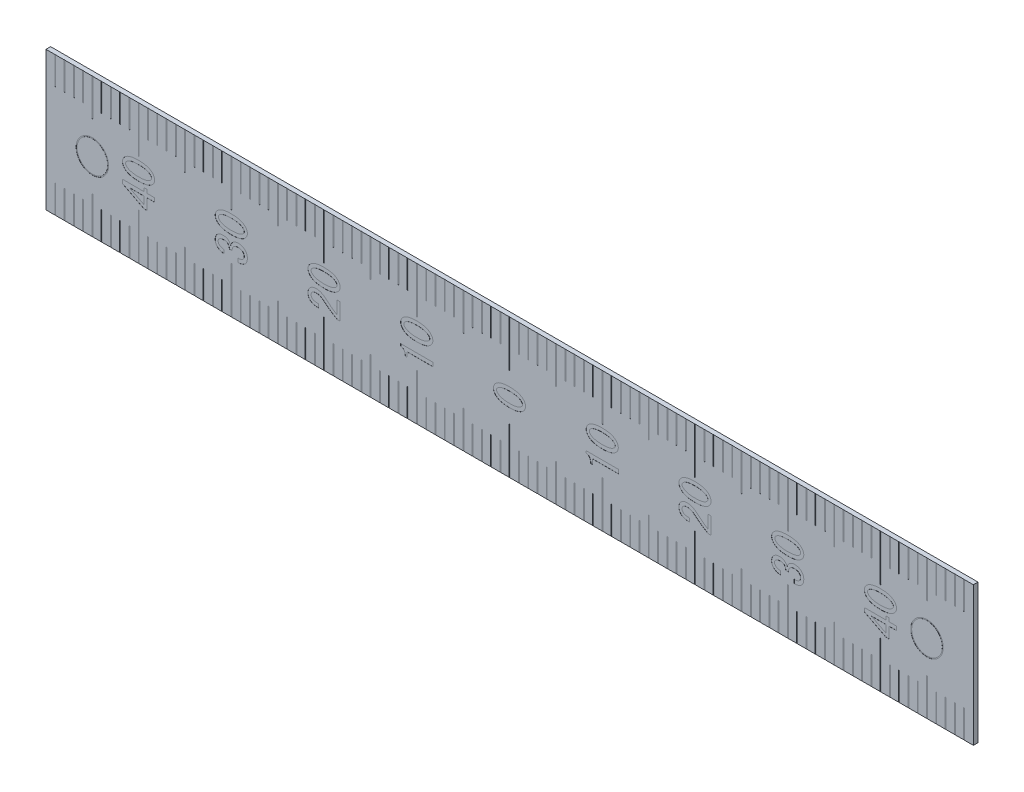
SolidWorks part; units mm, degrees
ref_plane "Front" through (0, 0, 0) normal (0, 0, 1) x (1, 0, 0)
ref_plane "Top" through (0, 0, 0) normal (0, 1, 0) x (1, 0, 0)
ref_plane "Right" through (0, 0, 0) normal (1, 0, 0) x (0, 0, -1)
sketch "Sketch1" plane through (0, 0, 0) normal (0, 0, 1) x (1, 0, 0)
  line L1 (0, -50) -> (0, 50)
  line L2 (0, -50) -> (15, -50)
  line L3 (15, -50) -> (15, 50)
  line L4 (0, 50) -> (15, 50)
  dimension "D1" = 100
  dimension "D2" = 15
extrude "Extrude1" add sketch "Sketch1" along normal blind 0.5
sketch "Sketch2" plane through (0, 0, 0.5) normal (0, 0, 1) x (1, 0, 0)
  line L0 (0, 50) -> (0, -50) construction
  line L1 (0, -50) -> (15, -50) construction
  line L2 (15, 50) -> (0, 50) construction
  circle A0 centre (7.5, -45) radius 1.75
  circle A1 centre (7.5, 45) radius 1.75
  circle A2 centre (7.5, -45) radius 1.65
  circle A3 centre (7.5, 45) radius 1.65
  dimension "D1" = 7.5
  dimension "D2" = 7.5
  dimension "D3" = 5
  dimension "D4" = 5
  dimension "D5" = 3.5
  dimension "D6" = 3.5
  dimension "D7" = 0.1
extrude "Extrude2" cut sketch "Sketch2" against normal blind 0.01
sketch "Sketch3" plane through (0, 0, 0.5) normal (0, 0, 1) x (1, 0, 0)
  line L0 (15, 50) -> (0, 50) construction
  line L1 (5.25, 28.25) -> (9.75, 28.25) construction
  line L2 (5.25, 18.25) -> (9.75, 18.25) construction
  line L3 (5.25, 8.25) -> (9.75, 8.25) construction
  line L5 (0, 50) -> (0, -50) construction
  line L6 (6.375, -1.75) -> (10.875, -1.75) construction
  line L7 (5.25, 38.25) -> (9.75, 38.25) construction
  line L8 (5.25, 38.25) -> (5.25, 41.75) construction
  line L9 (7.5, -50) -> (7.5, 50) construction
  line L10 (0, -50) -> (15, -50) construction
  line L11 (0, 40) -> (15, 40) construction
  line L12 (15, -50) -> (15, 50) construction
  line L13 (5.25, 41.75) -> (9.75, 41.75) construction
  line L14 (9.75, 38.25) -> (9.75, 41.75) construction
  line L15 (5.25, 38.25) -> (9.75, 41.75) construction
  line L16 (5.25, 41.75) -> (9.75, 38.25) construction
  line L17 (5.25, -11.75) -> (9.75, -11.75) construction
  line L18 (5.25, -21.75) -> (9.75, -21.75) construction
  line L19 (5.25, -31.75) -> (9.75, -31.75) construction
  line L20 (5.25, -41.75) -> (9.75, -41.75) construction
  circle A0 centre (7.5, 45) radius 1.75 construction
  text T0 "40" font "ＭＳ ゴシック" height 3.5
  text T1 "30" font "ＭＳ ゴシック" height 3.5
  text T2 "20" font "ＭＳ ゴシック" height 3.5
  text T3 "10" font "ＭＳ ゴシック" height 3.5
  text T4 "0"
  text T5 "10"
  text T6 "20"
  text T7 "30"
  text T8 "40"
  point P7 (7.5, 40)
  dimension "D2" = 7.5
  dimension "D1" = 4
  dimension "D3" = 1.125
  dimension "D6" = 10
  dimension "D5" = 4.5
  dimension "D7" = 3.5
extrude "Extrude3" cut sketch "Sketch3" against normal blind 0.01
sketch "Sketch4" plane through (0, 0, 0.5) normal (0, 0, 1) x (1, 0, 0)
  line L0 (15, 40.05) -> (10, 40.05)
  line L1 (15, -50) -> (15, 50) construction
  line L2 (10, 40.05) -> (10, 39.95)
  line L3 (10, 39.95) -> (15, 39.95)
  line L4 (15, 39.95) -> (15, 40.05)
  line L5 (15, 50) -> (0, 50) construction
  line L6 (15, 48.05) -> (15, 47.95)
  line L7 (15, 44.95) -> (11, 44.95)
  line L8 (15, 44.95) -> (15, 45.05)
  line L9 (15, 45.05) -> (11, 45.05)
  line L10 (11, 44.95) -> (11, 45.05)
  line L11 (15, 49.05) -> (12, 49.05)
  line L12 (15, 49.05) -> (15, 48.95)
  line L13 (15, 48.95) -> (12, 48.95)
  line L14 (12, 49.05) -> (12, 48.95)
  line L15 (15, 48.05) -> (12, 48.05)
  line L16 (15, 47.95) -> (12, 47.95)
  line L17 (12, 48.05) -> (12, 47.95)
  line L18 (15, 47.05) -> (15, 46.95)
  line L19 (15, 47.05) -> (12, 47.05)
  line L20 (15, 46.95) -> (12, 46.95)
  line L21 (12, 47.05) -> (12, 46.95)
  line L22 (15, 46.05) -> (15, 45.95)
  line L23 (15, 46.05) -> (12, 46.05)
  line L24 (15, 45.95) -> (12, 45.95)
  line L25 (12, 46.05) -> (12, 45.95)
  line L26 (15, 30.05) -> (10, 30.05)
  line L27 (10, 30.05) -> (10, 29.95)
  line L28 (10, 29.95) -> (15, 29.95)
  line L29 (15, 29.95) -> (15, 30.05)
  line L30 (15, 44.05) -> (15, 43.95)
  line L31 (15, 44.05) -> (12, 44.05)
  line L32 (15, 43.95) -> (12, 43.95)
  line L33 (12, 44.05) -> (12, 43.95)
  line L34 (15, 43.05) -> (15, 42.95)
  line L35 (15, 43.05) -> (12, 43.05)
  line L36 (15, 42.95) -> (12, 42.95)
  line L37 (12, 43.05) -> (12, 42.95)
  line L38 (15, 42.05) -> (15, 41.95)
  line L39 (15, 42.05) -> (12, 42.05)
  line L40 (15, 41.95) -> (12, 41.95)
  line L41 (12, 42.05) -> (12, 41.95)
  line L42 (15, 41.05) -> (15, 40.95)
  line L43 (15, 41.05) -> (12, 41.05)
  line L44 (15, 40.95) -> (12, 40.95)
  line L45 (12, 41.05) -> (12, 40.95)
  line L46 (12, 45.05) -> (12, 44.95)
  line L47 (15, 45.05) -> (12, 45.05)
  line L48 (15, 44.95) -> (12, 44.95)
  line L49 (15, 45.05) -> (15, 44.95)
  line L50 (15, 38.05) -> (15, 37.95)
  line L51 (15, 34.95) -> (11, 34.95)
  line L52 (15, 34.95) -> (15, 35.05)
  line L53 (15, 35.05) -> (11, 35.05)
  line L54 (11, 34.95) -> (11, 35.05)
  line L55 (15, 39.05) -> (12, 39.05)
  line L56 (15, 39.05) -> (15, 38.95)
  line L57 (15, 38.95) -> (12, 38.95)
  line L58 (12, 39.05) -> (12, 38.95)
  line L59 (15, 38.05) -> (12, 38.05)
  line L60 (15, 37.95) -> (12, 37.95)
  line L61 (12, 38.05) -> (12, 37.95)
  line L62 (15, 37.05) -> (15, 36.95)
  line L63 (15, 37.05) -> (12, 37.05)
  line L64 (15, 36.95) -> (12, 36.95)
  line L65 (12, 37.05) -> (12, 36.95)
  line L66 (15, 36.05) -> (15, 35.95)
  line L67 (15, 36.05) -> (12, 36.05)
  line L68 (15, 35.95) -> (12, 35.95)
  line L69 (12, 36.05) -> (12, 35.95)
  line L70 (15, 34.05) -> (15, 33.95)
  line L71 (15, 34.05) -> (12, 34.05)
  line L72 (15, 33.95) -> (12, 33.95)
  line L73 (12, 34.05) -> (12, 33.95)
  line L74 (15, 33.05) -> (15, 32.95)
  line L75 (15, 33.05) -> (12, 33.05)
  line L76 (15, 32.95) -> (12, 32.95)
  line L77 (12, 33.05) -> (12, 32.95)
  line L78 (15, 32.05) -> (15, 31.95)
  line L79 (15, 32.05) -> (12, 32.05)
  line L80 (15, 31.95) -> (12, 31.95)
  line L81 (12, 32.05) -> (12, 31.95)
  line L82 (15, 31.05) -> (15, 30.95)
  line L83 (15, 31.05) -> (12, 31.05)
  line L84 (15, 30.95) -> (12, 30.95)
  line L85 (12, 31.05) -> (12, 30.95)
  line L86 (15, 20.05) -> (10, 20.05)
  line L87 (10, 20.05) -> (10, 19.95)
  line L88 (10, 19.95) -> (15, 19.95)
  line L89 (15, 19.95) -> (15, 20.05)
  line L90 (15, 28.05) -> (15, 27.95)
  line L91 (15, 24.95) -> (11, 24.95)
  line L92 (15, 24.95) -> (15, 25.05)
  line L93 (15, 25.05) -> (11, 25.05)
  line L94 (11, 24.95) -> (11, 25.05)
  line L95 (15, 29.05) -> (12, 29.05)
  line L96 (15, 29.05) -> (15, 28.95)
  line L97 (15, 28.95) -> (12, 28.95)
  line L98 (12, 29.05) -> (12, 28.95)
  line L99 (15, 28.05) -> (12, 28.05)
  line L100 (15, 27.95) -> (12, 27.95)
  line L101 (12, 28.05) -> (12, 27.95)
  line L102 (15, 27.05) -> (15, 26.95)
  line L103 (15, 27.05) -> (12, 27.05)
  line L104 (15, 26.95) -> (12, 26.95)
  line L105 (12, 27.05) -> (12, 26.95)
  line L106 (15, 26.05) -> (15, 25.95)
  line L107 (15, 26.05) -> (12, 26.05)
  line L108 (15, 25.95) -> (12, 25.95)
  line L109 (12, 26.05) -> (12, 25.95)
  line L110 (15, 24.05) -> (15, 23.95)
  line L111 (15, 24.05) -> (12, 24.05)
  line L112 (15, 23.95) -> (12, 23.95)
  line L113 (12, 24.05) -> (12, 23.95)
  line L114 (15, 23.05) -> (15, 22.95)
  line L115 (15, 23.05) -> (12, 23.05)
  line L116 (15, 22.95) -> (12, 22.95)
  line L117 (12, 23.05) -> (12, 22.95)
  line L118 (15, 22.05) -> (15, 21.95)
  line L119 (15, 22.05) -> (12, 22.05)
  line L120 (15, 21.95) -> (12, 21.95)
  line L121 (12, 22.05) -> (12, 21.95)
  line L122 (15, 21.05) -> (15, 20.95)
  line L123 (15, 21.05) -> (12, 21.05)
  line L124 (15, 20.95) -> (12, 20.95)
  line L125 (12, 21.05) -> (12, 20.95)
  line L126 (15, 10.05) -> (10, 10.05)
  line L127 (10, 10.05) -> (10, 9.95)
  line L128 (10, 9.95) -> (15, 9.95)
  line L129 (15, 9.95) -> (15, 10.05)
  line L130 (15, 18.05) -> (15, 17.95)
  line L131 (15, 14.95) -> (11, 14.95)
  line L132 (15, 14.95) -> (15, 15.05)
  line L133 (15, 15.05) -> (11, 15.05)
  line L134 (11, 14.95) -> (11, 15.05)
  line L135 (15, 19.05) -> (12, 19.05)
  line L136 (15, 19.05) -> (15, 18.95)
  line L137 (15, 18.95) -> (12, 18.95)
  line L138 (12, 19.05) -> (12, 18.95)
  line L139 (15, 18.05) -> (12, 18.05)
  line L140 (15, 17.95) -> (12, 17.95)
  line L141 (12, 18.05) -> (12, 17.95)
  line L142 (15, 17.05) -> (15, 16.95)
  line L143 (15, 17.05) -> (12, 17.05)
  line L144 (15, 16.95) -> (12, 16.95)
  line L145 (12, 17.05) -> (12, 16.95)
  line L146 (15, 16.05) -> (15, 15.95)
  line L147 (15, 16.05) -> (12, 16.05)
  line L148 (15, 15.95) -> (12, 15.95)
  line L149 (12, 16.05) -> (12, 15.95)
  line L150 (15, 14.05) -> (15, 13.95)
  line L151 (15, 14.05) -> (12, 14.05)
  line L152 (15, 13.95) -> (12, 13.95)
  line L153 (12, 14.05) -> (12, 13.95)
  line L154 (15, 13.05) -> (15, 12.95)
  line L155 (15, 13.05) -> (12, 13.05)
  line L156 (15, 12.95) -> (12, 12.95)
  line L157 (12, 13.05) -> (12, 12.95)
  line L158 (15, 12.05) -> (15, 11.95)
  line L159 (15, 12.05) -> (12, 12.05)
  line L160 (15, 11.95) -> (12, 11.95)
  line L161 (12, 12.05) -> (12, 11.95)
  line L162 (15, 11.05) -> (15, 10.95)
  line L163 (15, 11.05) -> (12, 11.05)
  line L164 (15, 10.95) -> (12, 10.95)
  line L165 (12, 11.05) -> (12, 10.95)
  line L166 (7.5, 50) -> (7.5, 36.693) construction
  line L167 (3, 1.05) -> (3, 0.95)
  line L168 (0, 0.95) -> (3, 0.95)
  line L169 (0, 1.05) -> (3, 1.05)
  line L170 (15, 8.05) -> (15, 7.95)
  line L171 (15, 4.95) -> (11, 4.95)
  line L172 (15, 4.95) -> (15, 5.05)
  line L173 (15, 5.05) -> (11, 5.05)
  line L174 (11, 4.95) -> (11, 5.05)
  line L175 (15, 9.05) -> (12, 9.05)
  line L176 (15, 9.05) -> (15, 8.95)
  line L177 (15, 8.95) -> (12, 8.95)
  line L178 (12, 9.05) -> (12, 8.95)
  line L179 (15, 8.05) -> (12, 8.05)
  line L180 (15, 7.95) -> (12, 7.95)
  line L181 (12, 8.05) -> (12, 7.95)
  line L182 (15, 7.05) -> (15, 6.95)
  line L183 (15, 7.05) -> (12, 7.05)
  line L184 (15, 6.95) -> (12, 6.95)
  line L185 (12, 7.05) -> (12, 6.95)
  line L186 (15, 6.05) -> (15, 5.95)
  line L187 (15, 6.05) -> (12, 6.05)
  line L188 (15, 5.95) -> (12, 5.95)
  line L189 (12, 6.05) -> (12, 5.95)
  line L190 (15, 4.05) -> (15, 3.95)
  line L191 (15, 4.05) -> (12, 4.05)
  line L192 (15, 3.95) -> (12, 3.95)
  line L193 (12, 4.05) -> (12, 3.95)
  line L194 (15, 3.05) -> (15, 2.95)
  line L195 (15, 3.05) -> (12, 3.05)
  line L196 (15, 2.95) -> (12, 2.95)
  line L197 (12, 3.05) -> (12, 2.95)
  line L198 (15, 2.05) -> (15, 1.95)
  line L199 (15, 2.05) -> (12, 2.05)
  line L200 (15, 1.95) -> (12, 1.95)
  line L201 (12, 2.05) -> (12, 1.95)
  line L202 (15, 1.05) -> (15, 0.95)
  line L203 (15, 1.05) -> (12, 1.05)
  line L204 (15, 0.95) -> (12, 0.95)
  line L205 (12, 1.05) -> (12, 0.95)
  line L206 (15, 0.05) -> (10, 0.05)
  line L207 (10, 0.05) -> (10, -0.05)
  line L208 (10, -0.05) -> (15, -0.05)
  line L209 (15, -0.05) -> (15, 0.05)
  line L210 (0, 1.05) -> (0, 0.95)
  line L211 (3, 2.05) -> (3, 1.95)
  line L212 (0, 1.95) -> (3, 1.95)
  line L213 (0, 2.05) -> (3, 2.05)
  line L214 (0, 2.05) -> (0, 1.95)
  line L215 (3, 3.05) -> (3, 2.95)
  line L216 (0, 2.95) -> (3, 2.95)
  line L217 (0, 3.05) -> (3, 3.05)
  line L218 (0, 3.05) -> (0, 2.95)
  line L219 (3, 4.05) -> (3, 3.95)
  line L220 (0, 3.95) -> (3, 3.95)
  line L221 (0, 4.05) -> (3, 4.05)
  line L222 (0, 4.05) -> (0, 3.95)
  line L223 (3, 6.05) -> (3, 5.95)
  line L224 (0, 5.95) -> (3, 5.95)
  line L225 (0, 6.05) -> (3, 6.05)
  line L226 (0, 6.05) -> (0, 5.95)
  line L227 (3, 7.05) -> (3, 6.95)
  line L228 (0, 6.95) -> (3, 6.95)
  line L229 (0, 7.05) -> (3, 7.05)
  line L230 (0, 7.05) -> (0, 6.95)
  line L231 (3, 8.05) -> (3, 7.95)
  line L232 (0, 7.95) -> (3, 7.95)
  line L233 (0, 8.05) -> (3, 8.05)
  line L234 (3, 9.05) -> (3, 8.95)
  line L235 (0, 8.95) -> (3, 8.95)
  line L236 (0, 9.05) -> (0, 8.95)
  line L237 (0, 9.05) -> (3, 9.05)
  line L238 (4, 4.95) -> (4, 5.05)
  line L239 (0, 5.05) -> (4, 5.05)
  line L240 (0, 4.95) -> (0, 5.05)
  line L241 (0, 4.95) -> (4, 4.95)
  line L242 (0, 8.05) -> (0, 7.95)
  line L243 (3, 11.05) -> (3, 10.95)
  line L244 (0, 10.95) -> (3, 10.95)
  line L245 (0, 11.05) -> (3, 11.05)
  line L246 (0, 11.05) -> (0, 10.95)
  line L247 (3, 12.05) -> (3, 11.95)
  line L248 (0, 11.95) -> (3, 11.95)
  line L249 (0, 12.05) -> (3, 12.05)
  line L250 (0, 12.05) -> (0, 11.95)
  line L251 (3, 13.05) -> (3, 12.95)
  line L252 (0, 12.95) -> (3, 12.95)
  line L253 (0, 13.05) -> (3, 13.05)
  line L254 (0, 13.05) -> (0, 12.95)
  line L255 (3, 14.05) -> (3, 13.95)
  line L256 (0, 13.95) -> (3, 13.95)
  line L257 (0, 14.05) -> (3, 14.05)
  line L258 (0, 14.05) -> (0, 13.95)
  line L259 (3, 16.05) -> (3, 15.95)
  line L260 (0, 15.95) -> (3, 15.95)
  line L261 (0, 16.05) -> (3, 16.05)
  line L262 (0, 16.05) -> (0, 15.95)
  line L263 (3, 17.05) -> (3, 16.95)
  line L264 (0, 16.95) -> (3, 16.95)
  line L265 (0, 17.05) -> (3, 17.05)
  line L266 (0, 17.05) -> (0, 16.95)
  line L267 (3, 18.05) -> (3, 17.95)
  line L268 (0, 17.95) -> (3, 17.95)
  line L269 (0, 18.05) -> (3, 18.05)
  line L270 (3, 19.05) -> (3, 18.95)
  line L271 (0, 18.95) -> (3, 18.95)
  line L272 (0, 19.05) -> (0, 18.95)
  line L273 (0, 19.05) -> (3, 19.05)
  line L274 (4, 14.95) -> (4, 15.05)
  line L275 (0, 15.05) -> (4, 15.05)
  line L276 (0, 14.95) -> (0, 15.05)
  line L277 (0, 14.95) -> (4, 14.95)
  line L278 (0, 18.05) -> (0, 17.95)
  line L279 (0, 9.95) -> (0, 10.05)
  line L280 (5, 9.95) -> (0, 9.95)
  line L281 (5, 10.05) -> (5, 9.95)
  line L282 (0, 10.05) -> (5, 10.05)
  line L283 (3, 21.05) -> (3, 20.95)
  line L284 (0, 20.95) -> (3, 20.95)
  line L285 (0, 21.05) -> (3, 21.05)
  line L286 (0, 21.05) -> (0, 20.95)
  line L287 (3, 22.05) -> (3, 21.95)
  line L288 (0, 21.95) -> (3, 21.95)
  line L289 (0, 22.05) -> (3, 22.05)
  line L290 (0, 22.05) -> (0, 21.95)
  line L291 (3, 23.05) -> (3, 22.95)
  line L292 (0, 22.95) -> (3, 22.95)
  line L293 (0, 23.05) -> (3, 23.05)
  line L294 (0, 23.05) -> (0, 22.95)
  line L295 (3, 24.05) -> (3, 23.95)
  line L296 (0, 23.95) -> (3, 23.95)
  line L297 (0, 24.05) -> (3, 24.05)
  line L298 (0, 24.05) -> (0, 23.95)
  line L299 (3, 26.05) -> (3, 25.95)
  line L300 (0, 25.95) -> (3, 25.95)
  line L301 (0, 26.05) -> (3, 26.05)
  line L302 (0, 26.05) -> (0, 25.95)
  line L303 (3, 27.05) -> (3, 26.95)
  line L304 (0, 26.95) -> (3, 26.95)
  line L305 (0, 27.05) -> (3, 27.05)
  line L306 (0, 27.05) -> (0, 26.95)
  line L307 (3, 28.05) -> (3, 27.95)
  line L308 (0, 27.95) -> (3, 27.95)
  line L309 (0, 28.05) -> (3, 28.05)
  line L310 (3, 29.05) -> (3, 28.95)
  line L311 (0, 28.95) -> (3, 28.95)
  line L312 (0, 29.05) -> (0, 28.95)
  line L313 (0, 29.05) -> (3, 29.05)
  line L314 (4, 24.95) -> (4, 25.05)
  line L315 (0, 25.05) -> (4, 25.05)
  line L316 (0, 24.95) -> (0, 25.05)
  line L317 (0, 24.95) -> (4, 24.95)
  line L318 (0, 28.05) -> (0, 27.95)
  line L319 (0, 19.95) -> (0, 20.05)
  line L320 (5, 19.95) -> (0, 19.95)
  line L321 (5, 20.05) -> (5, 19.95)
  line L322 (0, 20.05) -> (5, 20.05)
  line L323 (3, 31.05) -> (3, 30.95)
  line L324 (0, 30.95) -> (3, 30.95)
  line L325 (0, 31.05) -> (3, 31.05)
  line L326 (0, 31.05) -> (0, 30.95)
  line L327 (3, 32.05) -> (3, 31.95)
  line L328 (0, 31.95) -> (3, 31.95)
  line L329 (0, 32.05) -> (3, 32.05)
  line L330 (0, 32.05) -> (0, 31.95)
  line L331 (3, 33.05) -> (3, 32.95)
  line L332 (0, 32.95) -> (3, 32.95)
  line L333 (0, 33.05) -> (3, 33.05)
  line L334 (0, 33.05) -> (0, 32.95)
  line L335 (3, 34.05) -> (3, 33.95)
  line L336 (0, 33.95) -> (3, 33.95)
  line L337 (0, 34.05) -> (3, 34.05)
  line L338 (0, 34.05) -> (0, 33.95)
  line L339 (3, 36.05) -> (3, 35.95)
  line L340 (0, 35.95) -> (3, 35.95)
  line L341 (0, 36.05) -> (3, 36.05)
  line L342 (0, 36.05) -> (0, 35.95)
  line L343 (3, 37.05) -> (3, 36.95)
  line L344 (0, 36.95) -> (3, 36.95)
  line L345 (0, 37.05) -> (3, 37.05)
  line L346 (0, 37.05) -> (0, 36.95)
  line L347 (3, 38.05) -> (3, 37.95)
  line L348 (0, 37.95) -> (3, 37.95)
  line L349 (0, 38.05) -> (3, 38.05)
  line L350 (3, 39.05) -> (3, 38.95)
  line L351 (0, 38.95) -> (3, 38.95)
  line L352 (0, 39.05) -> (0, 38.95)
  line L353 (0, 39.05) -> (3, 39.05)
  line L354 (4, 34.95) -> (4, 35.05)
  line L355 (0, 35.05) -> (4, 35.05)
  line L356 (0, 34.95) -> (0, 35.05)
  line L357 (0, 34.95) -> (4, 34.95)
  line L358 (0, 38.05) -> (0, 37.95)
  line L359 (3, 41.05) -> (3, 40.95)
  line L360 (0, 40.95) -> (3, 40.95)
  line L361 (0, 41.05) -> (3, 41.05)
  line L362 (0, 41.05) -> (0, 40.95)
  line L363 (3, 42.05) -> (3, 41.95)
  line L364 (0, 41.95) -> (3, 41.95)
  line L365 (0, 42.05) -> (3, 42.05)
  line L366 (0, 42.05) -> (0, 41.95)
  line L367 (3, 43.05) -> (3, 42.95)
  line L368 (0, 42.95) -> (3, 42.95)
  line L369 (0, 43.05) -> (3, 43.05)
  line L370 (0, 43.05) -> (0, 42.95)
  line L371 (3, 44.05) -> (3, 43.95)
  line L372 (0, 43.95) -> (3, 43.95)
  line L373 (0, 44.05) -> (3, 44.05)
  line L374 (0, 44.05) -> (0, 43.95)
  line L375 (0, 29.95) -> (0, 30.05)
  line L376 (5, 29.95) -> (0, 29.95)
  line L377 (5, 30.05) -> (5, 29.95)
  line L378 (0, 30.05) -> (5, 30.05)
  line L379 (3, 46.05) -> (3, 45.95)
  line L380 (0, 45.95) -> (3, 45.95)
  line L381 (0, 46.05) -> (3, 46.05)
  line L382 (0, 46.05) -> (0, 45.95)
  line L383 (3, 47.05) -> (3, 46.95)
  line L384 (0, 46.95) -> (3, 46.95)
  line L385 (0, 47.05) -> (3, 47.05)
  line L386 (0, 47.05) -> (0, 46.95)
  line L387 (3, 48.05) -> (3, 47.95)
  line L388 (0, 47.95) -> (3, 47.95)
  line L389 (0, 48.05) -> (3, 48.05)
  line L390 (3, 49.05) -> (3, 48.95)
  line L391 (0, 48.95) -> (3, 48.95)
  line L392 (0, 49.05) -> (0, 48.95)
  line L393 (0, 49.05) -> (3, 49.05)
  line L394 (4, 44.95) -> (4, 45.05)
  line L395 (0, 45.05) -> (4, 45.05)
  line L396 (0, 44.95) -> (0, 45.05)
  line L397 (0, 44.95) -> (4, 44.95)
  line L398 (0, 48.05) -> (0, 47.95)
  line L399 (0, 39.95) -> (0, 40.05)
  line L400 (5, 39.95) -> (0, 39.95)
  line L401 (5, 40.05) -> (5, 39.95)
  line L402 (0, 40.05) -> (5, 40.05)
  line L403 (15, 0.05) -> (10, 0.05)
  line L404 (10, 0.05) -> (10, -0.05)
  line L405 (10, -0.05) -> (15, -0.05)
  line L406 (15, -0.05) -> (15, 0.05)
  line L407 (3, -8.95) -> (3, -9.05)
  line L408 (0, -9.05) -> (3, -9.05)
  line L409 (0, -8.95) -> (3, -8.95)
  line L410 (15, -1.95) -> (15, -2.05)
  line L411 (15, -5.05) -> (11, -5.05)
  line L412 (15, -5.05) -> (15, -4.95)
  line L413 (15, -4.95) -> (11, -4.95)
  line L414 (11, -5.05) -> (11, -4.95)
  line L415 (15, -0.95) -> (12, -0.95)
  line L416 (15, -0.95) -> (15, -1.05)
  line L417 (15, -1.05) -> (12, -1.05)
  line L418 (12, -0.95) -> (12, -1.05)
  line L419 (15, -1.95) -> (12, -1.95)
  line L420 (15, -2.05) -> (12, -2.05)
  line L421 (12, -1.95) -> (12, -2.05)
  line L422 (15, -2.95) -> (15, -3.05)
  line L423 (15, -2.95) -> (12, -2.95)
  line L424 (15, -3.05) -> (12, -3.05)
  line L425 (12, -2.95) -> (12, -3.05)
  line L426 (15, -3.95) -> (15, -4.05)
  line L427 (15, -3.95) -> (12, -3.95)
  line L428 (15, -4.05) -> (12, -4.05)
  line L429 (12, -3.95) -> (12, -4.05)
  line L430 (15, -5.95) -> (15, -6.05)
  line L431 (15, -5.95) -> (12, -5.95)
  line L432 (15, -6.05) -> (12, -6.05)
  line L433 (12, -5.95) -> (12, -6.05)
  line L434 (15, -6.95) -> (15, -7.05)
  line L435 (15, -6.95) -> (12, -6.95)
  line L436 (15, -7.05) -> (12, -7.05)
  line L437 (12, -6.95) -> (12, -7.05)
  line L438 (15, -7.95) -> (15, -8.05)
  line L439 (15, -7.95) -> (12, -7.95)
  line L440 (15, -8.05) -> (12, -8.05)
  line L441 (12, -7.95) -> (12, -8.05)
  line L442 (15, -8.95) -> (15, -9.05)
  line L443 (15, -8.95) -> (12, -8.95)
  line L444 (15, -9.05) -> (12, -9.05)
  line L445 (12, -8.95) -> (12, -9.05)
  line L446 (0, -8.95) -> (0, -9.05)
  line L447 (3, -7.95) -> (3, -8.05)
  line L448 (0, -8.05) -> (3, -8.05)
  line L449 (0, -7.95) -> (3, -7.95)
  line L450 (0, -7.95) -> (0, -8.05)
  line L451 (3, -6.95) -> (3, -7.05)
  line L452 (0, -7.05) -> (3, -7.05)
  line L453 (0, -6.95) -> (3, -6.95)
  line L454 (0, -6.95) -> (0, -7.05)
  line L455 (3, -5.95) -> (3, -6.05)
  line L456 (0, -6.05) -> (3, -6.05)
  line L457 (0, -5.95) -> (3, -5.95)
  line L458 (0, -5.95) -> (0, -6.05)
  line L459 (3, -3.95) -> (3, -4.05)
  line L460 (0, -4.05) -> (3, -4.05)
  line L461 (0, -3.95) -> (3, -3.95)
  line L462 (0, -3.95) -> (0, -4.05)
  line L463 (3, -2.95) -> (3, -3.05)
  line L464 (0, -3.05) -> (3, -3.05)
  line L465 (0, -2.95) -> (3, -2.95)
  line L466 (0, -2.95) -> (0, -3.05)
  line L467 (3, -1.95) -> (3, -2.05)
  line L468 (0, -2.05) -> (3, -2.05)
  line L469 (0, -1.95) -> (3, -1.95)
  line L470 (3, -0.95) -> (3, -1.05)
  line L471 (0, -1.05) -> (3, -1.05)
  line L472 (0, -0.95) -> (0, -1.05)
  line L473 (0, -0.95) -> (3, -0.95)
  line L474 (4, -5.05) -> (4, -4.95)
  line L475 (0, -4.95) -> (4, -4.95)
  line L476 (0, -5.05) -> (0, -4.95)
  line L477 (0, -5.05) -> (4, -5.05)
  line L478 (0, -1.95) -> (0, -2.05)
  line L479 (0, -0.05) -> (0, 0.05)
  line L480 (5, -0.05) -> (0, -0.05)
  line L481 (5, 0.05) -> (5, -0.05)
  line L482 (0, 0.05) -> (5, 0.05)
  line L483 (15, -9.95) -> (10, -9.95)
  line L484 (10, -9.95) -> (10, -10.05)
  line L485 (10, -10.05) -> (15, -10.05)
  line L486 (15, -10.05) -> (15, -9.95)
  line L487 (3, -18.95) -> (3, -19.05)
  line L488 (0, -19.05) -> (3, -19.05)
  line L489 (0, -18.95) -> (3, -18.95)
  line L490 (15, -11.95) -> (15, -12.05)
  line L491 (15, -15.05) -> (11, -15.05)
  line L492 (15, -15.05) -> (15, -14.95)
  line L493 (15, -14.95) -> (11, -14.95)
  line L494 (11, -15.05) -> (11, -14.95)
  line L495 (15, -10.95) -> (12, -10.95)
  line L496 (15, -10.95) -> (15, -11.05)
  line L497 (15, -11.05) -> (12, -11.05)
  line L498 (12, -10.95) -> (12, -11.05)
  line L499 (15, -11.95) -> (12, -11.95)
  line L500 (15, -12.05) -> (12, -12.05)
  line L501 (12, -11.95) -> (12, -12.05)
  line L502 (15, -12.95) -> (15, -13.05)
  line L503 (15, -12.95) -> (12, -12.95)
  line L504 (15, -13.05) -> (12, -13.05)
  line L505 (12, -12.95) -> (12, -13.05)
  line L506 (15, -13.95) -> (15, -14.05)
  line L507 (15, -13.95) -> (12, -13.95)
  line L508 (15, -14.05) -> (12, -14.05)
  line L509 (12, -13.95) -> (12, -14.05)
  line L510 (15, -15.95) -> (15, -16.05)
  line L511 (15, -15.95) -> (12, -15.95)
  line L512 (15, -16.05) -> (12, -16.05)
  line L513 (12, -15.95) -> (12, -16.05)
  line L514 (15, -16.95) -> (15, -17.05)
  line L515 (15, -16.95) -> (12, -16.95)
  line L516 (15, -17.05) -> (12, -17.05)
  line L517 (12, -16.95) -> (12, -17.05)
  line L518 (15, -17.95) -> (15, -18.05)
  line L519 (15, -17.95) -> (12, -17.95)
  line L520 (15, -18.05) -> (12, -18.05)
  line L521 (12, -17.95) -> (12, -18.05)
  line L522 (15, -18.95) -> (15, -19.05)
  line L523 (15, -18.95) -> (12, -18.95)
  line L524 (15, -19.05) -> (12, -19.05)
  line L525 (12, -18.95) -> (12, -19.05)
  line L526 (0, -18.95) -> (0, -19.05)
  line L527 (3, -17.95) -> (3, -18.05)
  line L528 (0, -18.05) -> (3, -18.05)
  line L529 (0, -17.95) -> (3, -17.95)
  line L530 (0, -17.95) -> (0, -18.05)
  line L531 (3, -16.95) -> (3, -17.05)
  line L532 (0, -17.05) -> (3, -17.05)
  line L533 (0, -16.95) -> (3, -16.95)
  line L534 (0, -16.95) -> (0, -17.05)
  line L535 (3, -15.95) -> (3, -16.05)
  line L536 (0, -16.05) -> (3, -16.05)
  line L537 (0, -15.95) -> (3, -15.95)
  line L538 (0, -15.95) -> (0, -16.05)
  line L539 (3, -13.95) -> (3, -14.05)
  line L540 (0, -14.05) -> (3, -14.05)
  line L541 (0, -13.95) -> (3, -13.95)
  line L542 (0, -13.95) -> (0, -14.05)
  line L543 (3, -12.95) -> (3, -13.05)
  line L544 (0, -13.05) -> (3, -13.05)
  line L545 (0, -12.95) -> (3, -12.95)
  line L546 (0, -12.95) -> (0, -13.05)
  line L547 (3, -11.95) -> (3, -12.05)
  line L548 (0, -12.05) -> (3, -12.05)
  line L549 (0, -11.95) -> (3, -11.95)
  line L550 (3, -10.95) -> (3, -11.05)
  line L551 (0, -11.05) -> (3, -11.05)
  line L552 (0, -10.95) -> (0, -11.05)
  line L553 (0, -10.95) -> (3, -10.95)
  line L554 (4, -15.05) -> (4, -14.95)
  line L555 (0, -14.95) -> (4, -14.95)
  line L556 (0, -15.05) -> (0, -14.95)
  line L557 (0, -15.05) -> (4, -15.05)
  line L558 (0, -11.95) -> (0, -12.05)
  line L559 (0, -10.05) -> (0, -9.95)
  line L560 (5, -10.05) -> (0, -10.05)
  line L561 (5, -9.95) -> (5, -10.05)
  line L562 (0, -9.95) -> (5, -9.95)
  line L563 (15, -19.95) -> (10, -19.95)
  line L564 (10, -19.95) -> (10, -20.05)
  line L565 (10, -20.05) -> (15, -20.05)
  line L566 (15, -20.05) -> (15, -19.95)
  line L567 (3, -28.95) -> (3, -29.05)
  line L568 (0, -29.05) -> (3, -29.05)
  line L569 (0, -28.95) -> (3, -28.95)
  line L570 (15, -21.95) -> (15, -22.05)
  line L571 (15, -25.05) -> (11, -25.05)
  line L572 (15, -25.05) -> (15, -24.95)
  line L573 (15, -24.95) -> (11, -24.95)
  line L574 (11, -25.05) -> (11, -24.95)
  line L575 (15, -20.95) -> (12, -20.95)
  line L576 (15, -20.95) -> (15, -21.05)
  line L577 (15, -21.05) -> (12, -21.05)
  line L578 (12, -20.95) -> (12, -21.05)
  line L579 (15, -21.95) -> (12, -21.95)
  line L580 (15, -22.05) -> (12, -22.05)
  line L581 (12, -21.95) -> (12, -22.05)
  line L582 (15, -22.95) -> (15, -23.05)
  line L583 (15, -22.95) -> (12, -22.95)
  line L584 (15, -23.05) -> (12, -23.05)
  line L585 (12, -22.95) -> (12, -23.05)
  line L586 (15, -23.95) -> (15, -24.05)
  line L587 (15, -23.95) -> (12, -23.95)
  line L588 (15, -24.05) -> (12, -24.05)
  line L589 (12, -23.95) -> (12, -24.05)
  line L590 (15, -25.95) -> (15, -26.05)
  line L591 (15, -25.95) -> (12, -25.95)
  line L592 (15, -26.05) -> (12, -26.05)
  line L593 (12, -25.95) -> (12, -26.05)
  line L594 (15, -26.95) -> (15, -27.05)
  line L595 (15, -26.95) -> (12, -26.95)
  line L596 (15, -27.05) -> (12, -27.05)
  line L597 (12, -26.95) -> (12, -27.05)
  line L598 (15, -27.95) -> (15, -28.05)
  line L599 (15, -27.95) -> (12, -27.95)
  line L600 (15, -28.05) -> (12, -28.05)
  line L601 (12, -27.95) -> (12, -28.05)
  line L602 (15, -28.95) -> (15, -29.05)
  line L603 (15, -28.95) -> (12, -28.95)
  line L604 (15, -29.05) -> (12, -29.05)
  line L605 (12, -28.95) -> (12, -29.05)
  line L606 (0, -28.95) -> (0, -29.05)
  line L607 (3, -27.95) -> (3, -28.05)
  line L608 (0, -28.05) -> (3, -28.05)
  line L609 (0, -27.95) -> (3, -27.95)
  line L610 (0, -27.95) -> (0, -28.05)
  line L611 (3, -26.95) -> (3, -27.05)
  line L612 (0, -27.05) -> (3, -27.05)
  line L613 (0, -26.95) -> (3, -26.95)
  line L614 (0, -26.95) -> (0, -27.05)
  line L615 (3, -25.95) -> (3, -26.05)
  line L616 (0, -26.05) -> (3, -26.05)
  line L617 (0, -25.95) -> (3, -25.95)
  line L618 (0, -25.95) -> (0, -26.05)
  line L619 (3, -23.95) -> (3, -24.05)
  line L620 (0, -24.05) -> (3, -24.05)
  line L621 (0, -23.95) -> (3, -23.95)
  line L622 (0, -23.95) -> (0, -24.05)
  line L623 (3, -22.95) -> (3, -23.05)
  line L624 (0, -23.05) -> (3, -23.05)
  line L625 (0, -22.95) -> (3, -22.95)
  line L626 (0, -22.95) -> (0, -23.05)
  line L627 (3, -21.95) -> (3, -22.05)
  line L628 (0, -22.05) -> (3, -22.05)
  line L629 (0, -21.95) -> (3, -21.95)
  line L630 (3, -20.95) -> (3, -21.05)
  line L631 (0, -21.05) -> (3, -21.05)
  line L632 (0, -20.95) -> (0, -21.05)
  line L633 (0, -20.95) -> (3, -20.95)
  line L634 (4, -25.05) -> (4, -24.95)
  line L635 (0, -24.95) -> (4, -24.95)
  line L636 (0, -25.05) -> (0, -24.95)
  line L637 (0, -25.05) -> (4, -25.05)
  line L638 (0, -21.95) -> (0, -22.05)
  line L639 (0, -20.05) -> (0, -19.95)
  line L640 (5, -20.05) -> (0, -20.05)
  line L641 (5, -19.95) -> (5, -20.05)
  line L642 (0, -19.95) -> (5, -19.95)
  line L643 (15, -29.95) -> (10, -29.95)
  line L644 (10, -29.95) -> (10, -30.05)
  line L645 (10, -30.05) -> (15, -30.05)
  line L646 (15, -30.05) -> (15, -29.95)
  line L647 (3, -38.95) -> (3, -39.05)
  line L648 (0, -39.05) -> (3, -39.05)
  line L649 (0, -38.95) -> (3, -38.95)
  line L650 (15, -31.95) -> (15, -32.05)
  line L651 (15, -35.05) -> (11, -35.05)
  line L652 (15, -35.05) -> (15, -34.95)
  line L653 (15, -34.95) -> (11, -34.95)
  line L654 (11, -35.05) -> (11, -34.95)
  line L655 (15, -30.95) -> (12, -30.95)
  line L656 (15, -30.95) -> (15, -31.05)
  line L657 (15, -31.05) -> (12, -31.05)
  line L658 (12, -30.95) -> (12, -31.05)
  line L659 (15, -31.95) -> (12, -31.95)
  line L660 (15, -32.05) -> (12, -32.05)
  line L661 (12, -31.95) -> (12, -32.05)
  line L662 (15, -32.95) -> (15, -33.05)
  line L663 (15, -32.95) -> (12, -32.95)
  line L664 (15, -33.05) -> (12, -33.05)
  line L665 (12, -32.95) -> (12, -33.05)
  line L666 (15, -33.95) -> (15, -34.05)
  line L667 (15, -33.95) -> (12, -33.95)
  line L668 (15, -34.05) -> (12, -34.05)
  line L669 (12, -33.95) -> (12, -34.05)
  line L670 (15, -35.95) -> (15, -36.05)
  line L671 (15, -35.95) -> (12, -35.95)
  line L672 (15, -36.05) -> (12, -36.05)
  line L673 (12, -35.95) -> (12, -36.05)
  line L674 (15, -36.95) -> (15, -37.05)
  line L675 (15, -36.95) -> (12, -36.95)
  line L676 (15, -37.05) -> (12, -37.05)
  line L677 (12, -36.95) -> (12, -37.05)
  line L678 (15, -37.95) -> (15, -38.05)
  line L679 (15, -37.95) -> (12, -37.95)
  line L680 (15, -38.05) -> (12, -38.05)
  line L681 (12, -37.95) -> (12, -38.05)
  line L682 (15, -38.95) -> (15, -39.05)
  line L683 (15, -38.95) -> (12, -38.95)
  line L684 (15, -39.05) -> (12, -39.05)
  line L685 (12, -38.95) -> (12, -39.05)
  line L686 (0, -38.95) -> (0, -39.05)
  line L687 (3, -37.95) -> (3, -38.05)
  line L688 (0, -38.05) -> (3, -38.05)
  line L689 (0, -37.95) -> (3, -37.95)
  line L690 (0, -37.95) -> (0, -38.05)
  line L691 (3, -36.95) -> (3, -37.05)
  line L692 (0, -37.05) -> (3, -37.05)
  line L693 (0, -36.95) -> (3, -36.95)
  line L694 (0, -36.95) -> (0, -37.05)
  line L695 (3, -35.95) -> (3, -36.05)
  line L696 (0, -36.05) -> (3, -36.05)
  line L697 (0, -35.95) -> (3, -35.95)
  line L698 (0, -35.95) -> (0, -36.05)
  line L699 (3, -33.95) -> (3, -34.05)
  line L700 (0, -34.05) -> (3, -34.05)
  line L701 (0, -33.95) -> (3, -33.95)
  line L702 (0, -33.95) -> (0, -34.05)
  line L703 (3, -32.95) -> (3, -33.05)
  line L704 (0, -33.05) -> (3, -33.05)
  line L705 (0, -32.95) -> (3, -32.95)
  line L706 (0, -32.95) -> (0, -33.05)
  line L707 (3, -31.95) -> (3, -32.05)
  line L708 (0, -32.05) -> (3, -32.05)
  line L709 (0, -31.95) -> (3, -31.95)
  line L710 (3, -30.95) -> (3, -31.05)
  line L711 (0, -31.05) -> (3, -31.05)
  line L712 (0, -30.95) -> (0, -31.05)
  line L713 (0, -30.95) -> (3, -30.95)
  line L714 (4, -35.05) -> (4, -34.95)
  line L715 (0, -34.95) -> (4, -34.95)
  line L716 (0, -35.05) -> (0, -34.95)
  line L717 (0, -35.05) -> (4, -35.05)
  line L718 (0, -31.95) -> (0, -32.05)
  line L719 (0, -30.05) -> (0, -29.95)
  line L720 (5, -30.05) -> (0, -30.05)
  line L721 (5, -29.95) -> (5, -30.05)
  line L722 (0, -29.95) -> (5, -29.95)
  line L723 (15, -39.95) -> (10, -39.95)
  line L724 (10, -39.95) -> (10, -40.05)
  line L725 (10, -40.05) -> (15, -40.05)
  line L726 (15, -40.05) -> (15, -39.95)
  line L727 (3, -48.95) -> (3, -49.05)
  line L728 (0, -49.05) -> (3, -49.05)
  line L729 (0, -48.95) -> (3, -48.95)
  line L730 (15, -41.95) -> (15, -42.05)
  line L731 (15, -45.05) -> (11, -45.05)
  line L732 (15, -45.05) -> (15, -44.95)
  line L733 (15, -44.95) -> (11, -44.95)
  line L734 (11, -45.05) -> (11, -44.95)
  line L735 (15, -40.95) -> (12, -40.95)
  line L736 (15, -40.95) -> (15, -41.05)
  line L737 (15, -41.05) -> (12, -41.05)
  line L738 (12, -40.95) -> (12, -41.05)
  line L739 (15, -41.95) -> (12, -41.95)
  line L740 (15, -42.05) -> (12, -42.05)
  line L741 (12, -41.95) -> (12, -42.05)
  line L742 (15, -42.95) -> (15, -43.05)
  line L743 (15, -42.95) -> (12, -42.95)
  line L744 (15, -43.05) -> (12, -43.05)
  line L745 (12, -42.95) -> (12, -43.05)
  line L746 (15, -43.95) -> (15, -44.05)
  line L747 (15, -43.95) -> (12, -43.95)
  line L748 (15, -44.05) -> (12, -44.05)
  line L749 (12, -43.95) -> (12, -44.05)
  line L750 (15, -45.95) -> (15, -46.05)
  line L751 (15, -45.95) -> (12, -45.95)
  line L752 (15, -46.05) -> (12, -46.05)
  line L753 (12, -45.95) -> (12, -46.05)
  line L754 (15, -46.95) -> (15, -47.05)
  line L755 (15, -46.95) -> (12, -46.95)
  line L756 (15, -47.05) -> (12, -47.05)
  line L757 (12, -46.95) -> (12, -47.05)
  line L758 (15, -47.95) -> (15, -48.05)
  line L759 (15, -47.95) -> (12, -47.95)
  line L760 (15, -48.05) -> (12, -48.05)
  line L761 (12, -47.95) -> (12, -48.05)
  line L762 (15, -48.95) -> (15, -49.05)
  line L763 (15, -48.95) -> (12, -48.95)
  line L764 (15, -49.05) -> (12, -49.05)
  line L765 (12, -48.95) -> (12, -49.05)
  line L766 (0, -48.95) -> (0, -49.05)
  line L767 (3, -47.95) -> (3, -48.05)
  line L768 (0, -48.05) -> (3, -48.05)
  line L769 (0, -47.95) -> (3, -47.95)
  line L770 (0, -47.95) -> (0, -48.05)
  line L771 (3, -46.95) -> (3, -47.05)
  line L772 (0, -47.05) -> (3, -47.05)
  line L773 (0, -46.95) -> (3, -46.95)
  line L774 (0, -46.95) -> (0, -47.05)
  line L775 (3, -45.95) -> (3, -46.05)
  line L776 (0, -46.05) -> (3, -46.05)
  line L777 (0, -45.95) -> (3, -45.95)
  line L778 (0, -45.95) -> (0, -46.05)
  line L779 (3, -43.95) -> (3, -44.05)
  line L780 (0, -44.05) -> (3, -44.05)
  line L781 (0, -43.95) -> (3, -43.95)
  line L782 (0, -43.95) -> (0, -44.05)
  line L783 (3, -42.95) -> (3, -43.05)
  line L784 (0, -43.05) -> (3, -43.05)
  line L785 (0, -42.95) -> (3, -42.95)
  line L786 (0, -42.95) -> (0, -43.05)
  line L787 (3, -41.95) -> (3, -42.05)
  line L788 (0, -42.05) -> (3, -42.05)
  line L789 (0, -41.95) -> (3, -41.95)
  line L790 (3, -40.95) -> (3, -41.05)
  line L791 (0, -41.05) -> (3, -41.05)
  line L792 (0, -40.95) -> (0, -41.05)
  line L793 (0, -40.95) -> (3, -40.95)
  line L794 (4, -45.05) -> (4, -44.95)
  line L795 (0, -44.95) -> (4, -44.95)
  line L796 (0, -45.05) -> (0, -44.95)
  line L797 (0, -45.05) -> (4, -45.05)
  line L798 (0, -41.95) -> (0, -42.05)
  line L799 (0, -40.05) -> (0, -39.95)
  line L800 (5, -40.05) -> (0, -40.05)
  line L801 (5, -39.95) -> (5, -40.05)
  line L802 (0, -39.95) -> (5, -39.95)
  point P4 (15, 40)
  point P13 (15, 45)
  point P18 (15, 49)
  dimension "D1" = 10
  dimension "D2" = 0.1
  dimension "D3" = 5
  dimension "D4" = 5
  dimension "D5" = 0.1
  dimension "D6" = 1
  dimension "D7" = 0.1
  dimension "D8" = 3
  dimension "D9" = 4
  dimension "D12" = 6
  dimension "D10" = 9
  dimension "D11" = 5
extrude "Extrude4" cut sketch "Sketch4" against normal blind 0.01
move or copy body "Body-Move/Copy2" bodies to move or copy 105 copy no rotation origin (0, 0, 0) rotation axis (0, 0, 1) rotation angle 90
move or copy body "Body-Move/Copy3" bodies to move or copy 107 copy no translate (-50, -7.5, 0)
